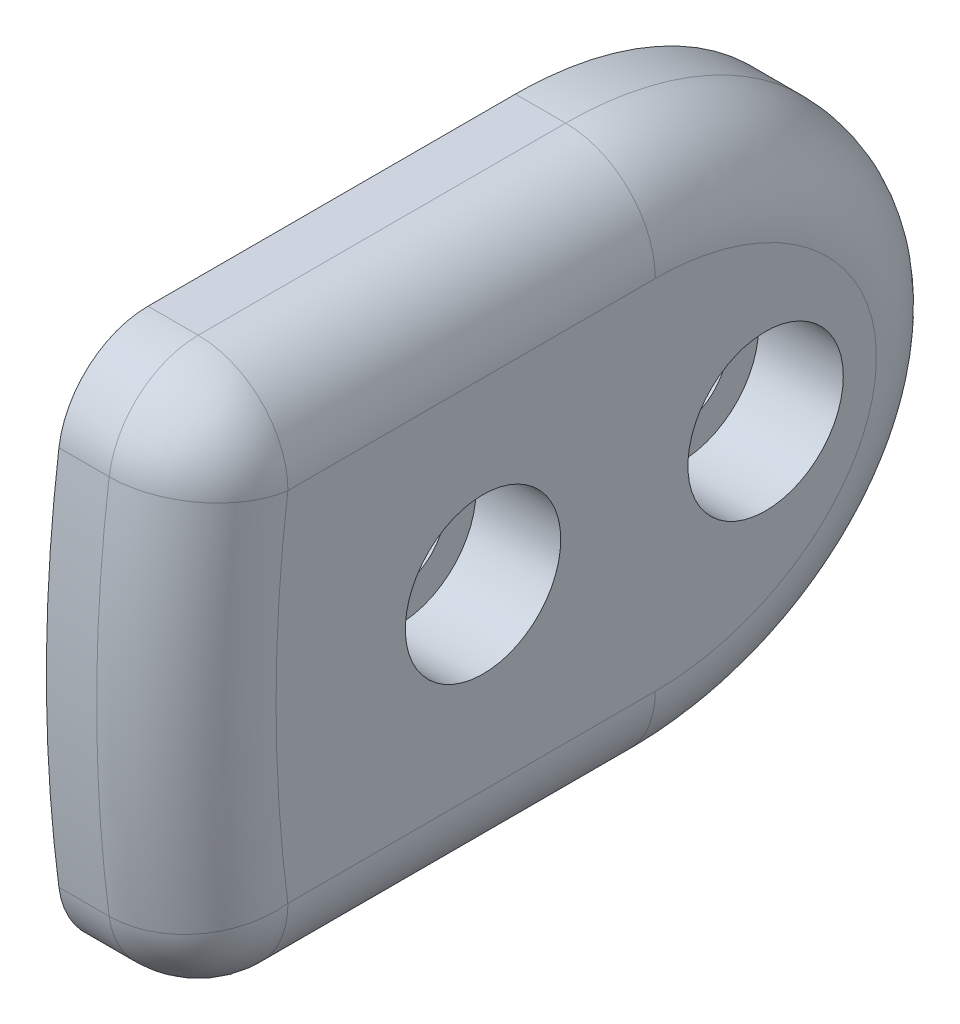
SolidWorks part; units mm, degrees
ref_plane "Front Plane" through (0, 0, 0) normal (0, 0, 1) x (1, 0, 0)
ref_plane "Top Plane" through (0, 0, 0) normal (0, 1, 0) x (1, 0, 0)
ref_plane "Right Plane" through (0, 0, 0) normal (1, 0, 0) x (0, 0, -1)
sketch "Sketch1" plane through (0, 0, 0) normal (1, 0, 0) x (0, 0, -1)
  line L0 (-95.8098, 19) -> (-69.8055, 19)
  line L1 (-103, 0) -> (-47.8055, 0)
  line L3 (0, 0) -> (-147.013, 0) construction
  arc A0 (-102.1152, 13.4719) -> (-103, 0) centre (0, 0) ccw
  arc A1 (-95.8098, 19) -> (-102.1152, 13.4719) centre (-95.8098, 12.64) ccw
  ellipse E0 centre (-69.8055, 0) end of major axis (-91.8055, 0) minor radius 19 (-47.8055, 0) -> (-69.8055, 19) ccw
  dimension "D1" = 103
  dimension "D2" = 6.36
  dimension "D3" = 11.1945
  dimension "D5" = 22
  dimension "D6" = 38
extrude "Extrude1" add sketch "Sketch1" along normal blind 9.906
mirror "Mirror1" about plane through (0, 0, 0) normal (0, 1, 0) of "Extrude1"
fillet "Fillet1" radius 6.35 6 edges at (9.906, 0, 47.8055) (9.906, -17.4223, 100.0026) (9.906, -19, 82.8076) (9.906, 19, 82.8076) (9.906, 17.4223, 100.0026) (9.906, 0, 103)
hole_wizard "CBORE for M6 SHCS1" positions "Sketch3" profile "Sketch2" counterbore size "M6" standard "Ansi Metric"
sketch "Sketch3" plane through (9.906, 0, 0) normal (1, 0, 0) x (0, 0, -1)
  point P0 (-82, 0)
  point P1 (-62, 0)
  dimension "D1" = 20
sketch "Sketch2" plane through (9.906, 0, 82) normal (0, 1, 0) x (0, 0, -1)
  line L0 (0, 0) -> (0, 9.906)
  line L1 (0, 9.906) -> (3.3, 9.906)
  line L3 (3.3, 9.906) -> (3.3, 6)
  line L4 (3.3, 6) -> (5.5, 6)
  line L5 (5.5, 6) -> (5.5, 0)
  line L7 (5.5, 0) -> (0, 0)
  line L11 (0, -6.35) -> (0, 107.95) construction
  dimension "Thru Hole Dia." = 6.6
  dimension "Thru Hole Depth" = 9.906
  dimension "C'Bore Dia." = 11
  dimension "C'Bore Depth" = 6
scale "Scale1" [suppressed]
